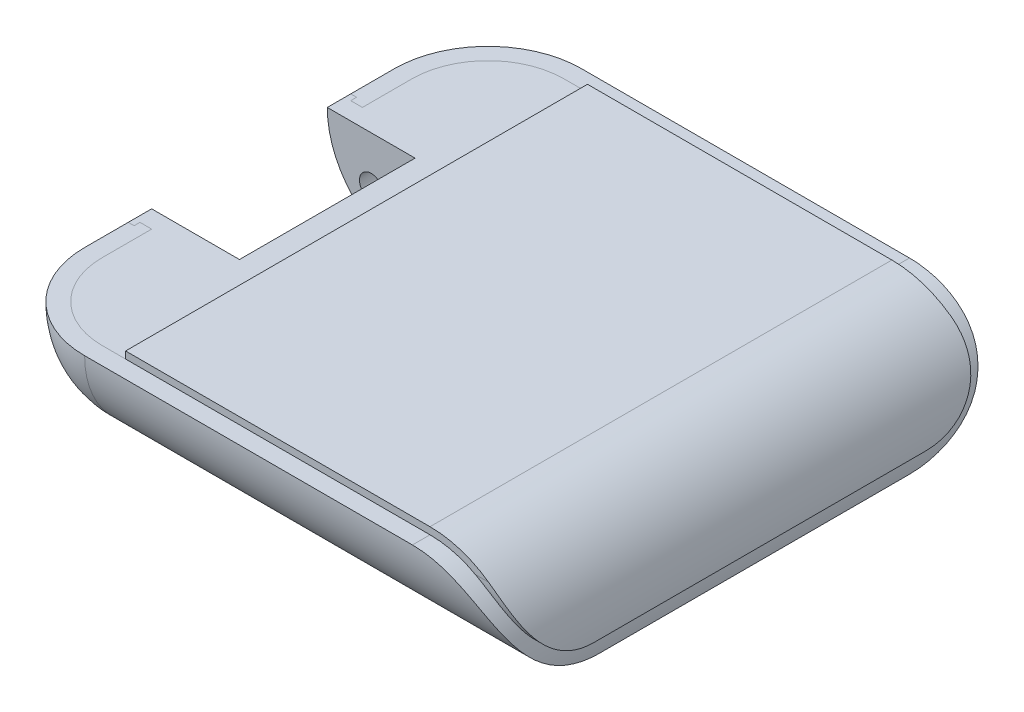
SolidWorks part; units mm, degrees
ref_plane "Front Plane" through (0, 0, 0) normal (0, 0, 1) x (1, 0, 0)
ref_plane "Top Plane" through (0, 0, 0) normal (0, 1, 0) x (1, 0, 0)
ref_plane "Right Plane" through (0, 0, 0) normal (1, 0, 0) x (0, 0, -1)
sketch "Sketch1" plane through (0, 0, 0) normal (0, 1, 0) x (1, 0, 0)
  line L1 (-22, 21.225) -> (22, 21.225)
  line L2 (-22, 21.225) -> (-22, -21.225)
  line L3 (-22, -21.225) -> (22, -21.225)
  line L4 (22, 21.225) -> (22, -21.225)
  point P4 (0, 21.225)
  point P6 (22, 0)
  dimension "D1" = 44
  dimension "D2" = 42.45
extrude "Boss-Extrude1" add sketch "Sketch1" along normal mid plane 8
fillet "Fillet1" radius 8 1 edges at (22, 4, 0)
fillet "Fillet2" radius 8 3 edges at (0, -4, -21.225) (-22, -4, 0) (0, -4, 21.225)
fillet "Fillet3" radius 8 2 edges at (-19.6569, -1.6569, 18.8819) (-19.6569, -1.6569, -18.8819)
sketch "Sketch2" plane through (0, 0, 0) normal (0, 1, 0) x (1, 0, 0)
  line L0 (-22, 13.225) -> (-22, -13.225) construction
  line L1 (-22, 7.5) -> (-14.5, 7.5)
  line L2 (-22, 7.5) -> (-22, -7.5)
  line L3 (-22, -7.5) -> (-14.5, -7.5)
  line L4 (-14.5, 7.5) -> (-14.5, -7.5)
  point P6 (-14.5, 0)
  dimension "D1" = 15
  dimension "D2" = 7.5
extrude "Cut-Extrude1" cut sketch "Sketch2" against normal through all both and the other way through all
shell "Shell3" thickness 1.5
sketch "Sketch19" plane through (0, 4, 0) normal (0, 1, 0) x (1, 0, 0)
  line L0 (-22, 9.5) -> (-21.5, 9.5)
  line L1 (-22, 13.225) -> (-22, 7.5) construction
  line L2 (-21.5, 9.5) -> (-21.5, 9)
  line L3 (-21.5, 9) -> (-13, 9)
  line L4 (-13, 9) -> (-13, -9)
  line L5 (-13, -9) -> (-21.5, -9)
  line L6 (-14.5, 0) -> (0, 0) construction
  line L7 (-14.5, -7.5) -> (-14.5, 7.5) construction
  line L8 (-21.5, -9) -> (-21.5, -9.5)
  line L9 (-21.5, -9.5) -> (-22, -9.5)
  line L10 (-22, -7.5) -> (-22, -13.225) construction
  line L12 (-13, 9) -> (-20.5, 9) construction
  line L13 (-13, -9) -> (-13, 9) construction
  line L14 (-22, 9.5) -> (-22, -9.5)
  dimension "D1" = 0.5
extrude "Cut-Extrude4" cut sketch "Sketch19" against normal through all
sketch "Sketch21" plane through (0, 0, 0) normal (0, 0, 1) x (1, 0, 0)
  line L1 (-14, 4) -> (14, 4) construction
  line L2 (-12, 4) -> (14, 4) construction
  line L3 (-12, 4.6) -> (14, 4.6)
  line L4 (-12, 3.2) -> (14, 3.2)
  line L7 (-12, 4.6) -> (-12, 3.2)
  line L8 (-14, 4.6) -> (14, 4.6) construction
  line L9 (-14, 4) -> (14, 4) construction
  line L10 (-14, 3.2) -> (14, 3.2) construction
  line L11 (21.042, -2.5) -> (22.4682, -2.5)
  line L12 (22, -4) -> (-14, -4) construction
  arc A0 (22, -4) -> (14, 4) centre (14, -4) ccw construction
  arc A1 (21.8581, -2.5) -> (14, 4) centre (14, -4) ccw construction
  arc A2 (22.4682, -2.5) -> (14, 4.6) centre (14, -4) ccw
  arc A3 (21.042, -2.5) -> (14, 3.2) centre (14, -4) ccw
  arc A4 (22.6, -4) -> (14, 4.6) centre (14, -4) ccw construction
  arc A5 (22, -4) -> (14, 4) centre (14, -4) ccw construction
  arc A6 (21.2, -4) -> (14, 3.2) centre (14, -4) ccw construction
  dimension "D1" = 0.6
  dimension "D3" = 10
  dimension "D4" = 1.5
  dimension "D2" = 0.8
extrude "Boss-Extrude4" add sketch "Sketch21" along normal up to vertex and the other way up to vertex separate body
fillet "Fillet7" radius 5.5 2 edges at (21.7551, -2.5, 19.725) (21.7551, -2.5, -19.725)
sketch "Sketch23" plane through (0, 4, 0) normal (0, 1, 0) x (1, 0, 0)
  line L0 (-12, -19.725) -> (-12, 19.725) construction
  line L1 (-12, -19.725) -> (-12, 19.725)
  line L2 (-21.5, 9.5) -> (-22, 9.5) construction
  line L3 (-21.5, 9) -> (-21.5, 9.5) construction
  line L4 (-20.5, 9) -> (-21.5, 9) construction
  line L5 (-20.5, 13.225) -> (-20.5, 9) construction
  line L6 (14, 19.725) -> (-14, 19.725) construction
  line L7 (-21.5, 9.5) -> (-22, 9.5)
  line L8 (-21.5, 9) -> (-21.5, 9.5)
  line L9 (-20.5, 9) -> (-21.5, 9)
  line L10 (-20.5, 13.225) -> (-20.5, 9)
  line L11 (-12, 19.725) -> (-14, 19.725)
  line L12 (-22, -9.5) -> (-21.5, -9.5) construction
  line L13 (-21.5, -9.5) -> (-21.5, -9) construction
  line L14 (-21.5, -9) -> (-20.5, -9) construction
  line L15 (-20.5, -9) -> (-20.5, -13.225) construction
  line L16 (-14, -19.725) -> (14, -19.725) construction
  line L17 (-22, -9.5) -> (-21.5, -9.5)
  line L18 (-21.5, -9.5) -> (-21.5, -9)
  line L19 (-21.5, -9) -> (-20.5, -9)
  line L20 (-20.5, -9) -> (-20.5, -13.225)
  line L21 (-14, -19.725) -> (-12, -19.725)
  line L22 (-22, 9.5) -> (-22, 7.5)
  line L23 (-22, 7.5) -> (-14.5, 7.5)
  line L24 (-14.5, 7.5) -> (-14.5, -7.5)
  line L25 (-14.5, -7.5) -> (-22, -7.5)
  line L26 (-22, -7.5) -> (-22, -9.5)
  arc A0 (-14, 19.725) -> (-20.5, 13.225) centre (-14, 13.225) ccw construction
  arc A1 (-14, 19.725) -> (-20.5, 13.225) centre (-14, 13.225) ccw
  arc A2 (-20.5, -13.225) -> (-14, -19.725) centre (-14, -13.225) ccw construction
  arc A3 (-20.5, -13.225) -> (-14, -19.725) centre (-14, -13.225) ccw
  dimension "D1" = 7.5
  dimension "D2" = 15
extrude "Boss-Extrude5" add sketch "Sketch23" against normal blind 2.5 separate body
sketch "Sketch28" plane through (0, 1.5, 0) normal (0, -1, 0) x (1, 0, 0)
  line L0 (-20.5, 9) -> (-13, 9)
  line L1 (-20.5, -9) -> (-13, -9)
  line L16 (-12, 19.725) -> (-14, 19.725)
  line L17 (-20.5, 13.225) -> (-20.5, 9)
  line L18 (-20.5, 9) -> (-21.5, 9)
  line L19 (-21.5, 9) -> (-21.5, 9.5)
  line L20 (-21.5, 9.5) -> (-22, 9.5)
  line L21 (-22, 9.5) -> (-22, 7.5)
  line L22 (-22, 7.5) -> (-14.5, 7.5)
  line L23 (-14.5, 7.5) -> (-14.5, -7.5)
  line L24 (-14.5, -7.5) -> (-22, -7.5)
  line L25 (-22, -7.5) -> (-22, -9.5)
  line L26 (-22, -9.5) -> (-21.5, -9.5)
  line L27 (-21.5, -9.5) -> (-21.5, -9)
  line L28 (-21.5, -9) -> (-20.5, -9)
  line L29 (-20.5, -9) -> (-20.5, -13.225)
  line L30 (-14, -19.725) -> (-12, -19.725)
  line L31 (-12, -19.725) -> (-12, 19.725)
  line L34 (-20.5, 9) -> (-21.5, 9)
  line L35 (-21.5, 9) -> (-21.5, 9.5)
  line L36 (-21.5, 9.5) -> (-22, 9.5)
  line L37 (-22, 9.5) -> (-22, 7.5)
  line L38 (-22, 7.5) -> (-14.5, 7.5)
  line L39 (-14.5, 7.5) -> (-14.5, -7.5)
  line L40 (-14.5, -7.5) -> (-22, -7.5)
  line L41 (-22, -7.5) -> (-22, -9.5)
  line L42 (-22, -9.5) -> (-21.5, -9.5)
  line L43 (-21.5, -9.5) -> (-21.5, -9)
  line L44 (-21.5, -9) -> (-20.5, -9)
  line L47 (-13, -9) -> (-13, 9)
  arc A2 (-14, 19.725) -> (-20.5, 13.225) centre (-14, 13.225) ccw
  arc A3 (-20.5, -13.225) -> (-14, -19.725) centre (-14, -13.225) ccw
  dimension "D1" = 0
extrude "Boss-Extrude6" add sketch "Sketch28" along normal up to surface separate body
sketch "Sketch24" plane through (0, 0, 0) normal (0, 0, 1) x (1, 0, 0)
  line L2 (-14, -4) -> (-14, 4)
  line L3 (-14, 4) -> (-22, 4)
  line L6 (-22, -4) -> (-22, 4) construction
  line L9 (-21.5, -4) -> (-13, -4) construction
  line L13 (-22, -4) -> (-21.5, -4) construction
  line L14 (-22, -4) -> (-22, 4)
  line L15 (-21.5, -4) -> (-14, -4)
  line L16 (-22, -4) -> (-21.5, -4)
  arc A1 (-22, 4) -> (-14, -4) centre (-14, 4) ccw
  arc A2 (-22, 4) -> (-14, -4) centre (-14, 4) ccw
  dimension "D1" = 0
extrude "Cut-Extrude5" cut sketch "Sketch24" against normal through all both and the other way through all
sketch "Sketch5" plane through (0, 0, 0) normal (0, 0, 1) x (1, 0, 0)
  line L2 (-14, 4) -> (-22, 4) construction
  circle A0 centre (-18.25, 0) radius 1
  dimension "D1" = 2
  dimension "D2" = 3.75
  dimension "D3" = 4
extrude "Cut-Extrude2" cut sketch "Sketch5" against normal up to next and the other way up to next
sketch "Sketch6" plane through (0, -4, 0) normal (0, -1, 0) x (1, 0, 0)
  line L1 (-4.5, 13.5) -> (13, 13.5)
  line L2 (-10.5, 7.5) -> (-10.5, -7.5)
  line L3 (-4.5, -13.5) -> (13, -13.5)
  line L4 (19, 7.5) -> (19, -7.5)
  line L5 (4.25, -13.5) -> (4.25, 13.5) construction
  line L6 (-10.5, 0) -> (19, 0) construction
  line L8 (22, 13.225) -> (22, -13.225) construction
  arc A0 (13, 13.5) -> (19, 7.5) centre (13, 7.5) cw
  arc A1 (13, -13.5) -> (19, -7.5) centre (13, -7.5) ccw
  arc A2 (-10.5, -7.5) -> (-4.5, -13.5) centre (-4.5, -7.5) ccw
  arc A3 (-4.5, 13.5) -> (-10.5, 7.5) centre (-4.5, 7.5) ccw
  point P232 (4.25, 0)
  dimension "D4" = 6
  dimension "D1" = 3
  dimension "D2" = 27
  dimension "D3" = 29.5
extrude "Boss-Extrude2" add sketch "Sketch6" along normal blind 0.6 separate body
sketch "Sketch8" plane through (0, -4.6, 0) normal (0, -1, 0) x (1, 0, 0)
  line L0 (17.2426, 11.7426) -> (-8.7426, -11.7426) construction
  line L1 (-8.7426, 11.7426) -> (17.2426, -11.7426) construction
  arc A0 (19, 7.5) -> (13, 13.5) centre (13, 7.5) ccw construction
  arc A1 (-10.5, -7.5) -> (-4.5, -13.5) centre (-4.5, -7.5) ccw construction
  arc A4 (-4.5, 13.5) -> (-10.5, 7.5) centre (-4.5, 7.5) ccw construction
  arc A5 (13, -13.5) -> (19, -7.5) centre (13, -7.5) ccw construction
  line B0 (4.1065, 3.9974) -> (4.054, 3.8951)
  line B1 (4.054, 3.8951) -> (3.9916, 3.9916)
  line B2 (3.9058, 3.9852) -> (3.8586, 3.8803)
  line B3 (3.8586, 3.8803) -> (3.7914, 3.9736)
  line B4 (3.706, 3.9628) -> (3.6641, 3.8557)
  line B5 (3.6641, 3.8557) -> (3.5923, 3.9456)
  line B6 (3.5076, 3.9305) -> (3.4711, 3.8214)
  line B7 (3.4711, 3.8214) -> (3.3949, 3.9075)
  line B8 (3.311, 3.8882) -> (3.2801, 3.7775)
  line B9 (3.2801, 3.7775) -> (3.1997, 3.8596)
  line B10 (3.1169, 3.8361) -> (3.0915, 3.724)
  line B11 (3.0915, 3.724) -> (3.0071, 3.802)
  line B12 (2.9256, 3.7744) -> (2.9059, 3.6611)
  line B13 (2.9059, 3.6611) -> (2.8176, 3.7347)
  line B14 (2.7376, 3.703) -> (2.7236, 3.5889)
  line B15 (2.7236, 3.5889) -> (2.6318, 3.658)
  line B16 (2.5534, 3.6224) -> (2.5453, 3.5077)
  line B17 (2.5453, 3.5077) -> (2.45, 3.5721)
  line B18 (2.3736, 3.5326) -> (2.3712, 3.4176)
  line B19 (2.3712, 3.4176) -> (2.2728, 3.4772)
  line B20 (2.1985, 3.4338) -> (2.2018, 3.3189)
  line B21 (2.2018, 3.3189) -> (2.1006, 3.3734)
  line B22 (2.0285, 3.3264) -> (2.0377, 3.2118)
  line B23 (2.0377, 3.2118) -> (1.9338, 3.2612)
  line B24 (1.8642, 3.2106) -> (1.8791, 3.0966)
  line B25 (1.8791, 3.0966) -> (1.7729, 3.1407)
  line B26 (1.7059, 3.0867) -> (1.7265, 2.9735)
  line B27 (1.7265, 2.9735) -> (1.6182, 3.0123)
  line B28 (1.554, 2.9549) -> (1.5803, 2.843)
  line B29 (1.5803, 2.843) -> (1.4702, 2.8762)
  line B30 (1.409, 2.8157) -> (1.4408, 2.7052)
  line B31 (1.4408, 2.7052) -> (1.3292, 2.7329)
  line B32 (1.2711, 2.6694) -> (1.3084, 2.5607)
  line B33 (1.3084, 2.5607) -> (1.1956, 2.5827)
  line B34 (1.1407, 2.5164) -> (1.1835, 2.4097)
  line B35 (1.1835, 2.4097) -> (1.0697, 2.426)
  line B36 (1.0182, 2.357) -> (1.0663, 2.2525)
  line B37 (1.0663, 2.2525) -> (0.9518, 2.2631)
  line B38 (0.9039, 2.1916) -> (0.9571, 2.0897)
  line B39 (0.9571, 2.0897) -> (0.8422, 2.0945)
  line B40 (0.798, 2.0207) -> (0.8563, 1.9216)
  line B41 (0.8563, 1.9216) -> (0.7413, 1.9207)
  line B42 (0.7008, 1.8447) -> (0.764, 1.7487)
  line B43 (0.764, 1.7487) -> (0.6492, 1.742)
  line B44 (0.6126, 1.6641) -> (0.6806, 1.5713)
  line B45 (0.6806, 1.5713) -> (0.5663, 1.5588)
  line B46 (0.5336, 1.4792) -> (0.6061, 1.39)
  line B47 (0.6061, 1.39) -> (0.4926, 1.3718)
  line B48 (0.4639, 1.2906) -> (0.5409, 1.2052)
  line B49 (0.5409, 1.2052) -> (0.4284, 1.1813)
  line B50 (0.4039, 1.0988) -> (0.485, 1.0173)
  line B51 (0.485, 1.0173) -> (0.3739, 0.9878)
  line B52 (0.3535, 0.9041) -> (0.4387, 0.8268)
  line B53 (0.4387, 0.8268) -> (0.3291, 0.7918)
  line B54 (0.313, 0.7072) -> (0.4019, 0.6343)
  line B55 (0.4019, 0.6343) -> (0.2943, 0.5938)
  line B56 (0.2825, 0.5085) -> (0.3749, 0.4401)
  line B57 (0.3749, 0.4401) -> (0.2695, 0.3942)
  line B58 (0.2619, 0.3085) -> (0.3577, 0.2449)
  line B59 (0.3577, 0.2449) -> (0.2547, 0.1938)
  line B60 (0.2515, 0.1078) -> (0.3503, 0.049)
  line B61 (0.3503, 0.049) -> (0.25, -0.0072)
  line B62 (0.2511, -0.0933) -> (0.3528, -0.147)
  line B63 (0.3528, -0.147) -> (0.2554, -0.2082)
  line B64 (0.2608, -0.2941) -> (0.3651, -0.3426)
  line B65 (0.3651, -0.3426) -> (0.2709, -0.4086)
  line B66 (0.2806, -0.4942) -> (0.3872, -0.5374)
  line B67 (0.3872, -0.5374) -> (0.2965, -0.6081)
  line B68 (0.3105, -0.693) -> (0.4191, -0.7308)
  line B69 (0.4191, -0.7308) -> (0.332, -0.8059)
  line B70 (0.3503, -0.89) -> (0.4606, -0.9223)
  line B71 (0.4606, -0.9223) -> (0.3775, -1.0018)
  line B72 (0.3999, -1.0848) -> (0.5118, -1.1116)
  line B73 (0.5118, -1.1116) -> (0.4327, -1.1951)
  line B74 (0.4593, -1.2769) -> (0.5723, -1.298)
  line B75 (0.5723, -1.298) -> (0.4976, -1.3854)
  line B76 (0.5282, -1.4658) -> (0.6422, -1.4811)
  line B77 (0.6422, -1.4811) -> (0.5719, -1.5721)
  line B78 (0.6066, -1.6509) -> (0.7212, -1.6605)
  line B79 (0.7212, -1.6605) -> (0.6555, -1.755)
  line B80 (0.6941, -1.8319) -> (0.8091, -1.8357)
  line B81 (0.8091, -1.8357) -> (0.7483, -1.9333)
  line B82 (0.7907, -2.0082) -> (0.9056, -2.0063)
  line B83 (0.9056, -2.0063) -> (0.8498, -2.1069)
  line B84 (0.8959, -2.1795) -> (1.0107, -2.1718)
  line B85 (1.0107, -2.1718) -> (0.96, -2.275)
  line B86 (1.0097, -2.3453) -> (1.1239, -2.3318)
  line B87 (1.1239, -2.3318) -> (1.0784, -2.4375)
  line B88 (1.1316, -2.5051) -> (1.245, -2.486)
  line B89 (1.245, -2.486) -> (1.2049, -2.5937)
  line B90 (1.2614, -2.6586) -> (1.3737, -2.6338)
  line B91 (1.3737, -2.6338) -> (1.3391, -2.7435)
  line B92 (1.3988, -2.8054) -> (1.5097, -2.775)
  line B93 (1.5097, -2.775) -> (1.4806, -2.8862)
  line B94 (1.5433, -2.9452) -> (1.6526, -2.9092)
  line B95 (1.6526, -2.9092) -> (1.6291, -3.0217)
  line B96 (1.6947, -3.0774) -> (1.802, -3.036)
  line B97 (1.802, -3.036) -> (1.7843, -3.1496)
  line B98 (1.8526, -3.2019) -> (1.9576, -3.1552)
  line B99 (1.9576, -3.1552) -> (1.9456, -3.2695)
  line B100 (2.0165, -3.3184) -> (2.1191, -3.2664)
  line B101 (2.1191, -3.2664) -> (2.1128, -3.3812)
  line B102 (2.186, -3.4264) -> (2.2859, -3.3693)
  line B103 (2.2859, -3.3693) -> (2.2854, -3.4843)
  line B104 (2.3608, -3.5258) -> (2.4576, -3.4637)
  line B105 (2.4576, -3.4637) -> (2.4629, -3.5786)
  line B106 (2.5403, -3.6162) -> (2.6339, -3.5494)
  line B107 (2.6339, -3.5494) -> (2.645, -3.6639)
  line B108 (2.7242, -3.6976) -> (2.8143, -3.6261)
  line B109 (2.8143, -3.6261) -> (2.8311, -3.7399)
  line B110 (2.9119, -3.7695) -> (2.9983, -3.6937)
  line B111 (2.9983, -3.6937) -> (3.0208, -3.8065)
  line B112 (3.103, -3.832) -> (3.1855, -3.7519)
  line B113 (3.1855, -3.7519) -> (3.2136, -3.8634)
  line B114 (3.297, -3.8848) -> (3.3753, -3.8007)
  line B115 (3.3753, -3.8007) -> (3.409, -3.9106)
  line B116 (3.4934, -3.9278) -> (3.5674, -3.8398)
  line B117 (3.5674, -3.8398) -> (3.6066, -3.9479)
  line B118 (3.6917, -3.9608) -> (3.7612, -3.8692)
  line B119 (3.7612, -3.8692) -> (3.8058, -3.9753)
  line B120 (3.8914, -3.9839) -> (3.9562, -3.8889)
  line B121 (3.9562, -3.8889) -> (4.0061, -3.9926)
  line B122 (4.092, -3.9969) -> (4.152, -3.8988)
  line B123 (4.152, -3.8988) -> (4.207, -3.9998)
  line B124 (4.293, -3.9998) -> (4.348, -3.8988)
  line B125 (4.348, -3.8988) -> (4.408, -3.9969)
  line B126 (4.4939, -3.9926) -> (4.5438, -3.8889)
  line B127 (4.5438, -3.8889) -> (4.6086, -3.9839)
  line B128 (4.6942, -3.9753) -> (4.7388, -3.8692)
  line B129 (4.7388, -3.8692) -> (4.8083, -3.9608)
  line B130 (4.8934, -3.9479) -> (4.9326, -3.8398)
  line B131 (4.9326, -3.8398) -> (5.0066, -3.9278)
  line B132 (5.091, -3.9106) -> (5.1247, -3.8007)
  line B133 (5.1247, -3.8007) -> (5.203, -3.8848)
  line B134 (5.2864, -3.8634) -> (5.3145, -3.7519)
  line B135 (5.3145, -3.7519) -> (5.397, -3.832)
  line B136 (5.4792, -3.8065) -> (5.5017, -3.6937)
  line B137 (5.5017, -3.6937) -> (5.5881, -3.7695)
  line B138 (5.6689, -3.7399) -> (5.6857, -3.6261)
  line B139 (5.6857, -3.6261) -> (5.7758, -3.6976)
  line B140 (5.855, -3.6639) -> (5.8661, -3.5494)
  line B141 (5.8661, -3.5494) -> (5.9597, -3.6162)
  line B142 (6.0371, -3.5786) -> (6.0424, -3.4637)
  line B143 (6.0424, -3.4637) -> (6.1392, -3.5258)
  line B144 (6.2146, -3.4843) -> (6.2141, -3.3693)
  line B145 (6.2141, -3.3693) -> (6.314, -3.4264)
  line B146 (6.3872, -3.3812) -> (6.3809, -3.2664)
  line B147 (6.3809, -3.2664) -> (6.4835, -3.3184)
  line B148 (6.5544, -3.2695) -> (6.5424, -3.1552)
  line B149 (6.5424, -3.1552) -> (6.6474, -3.2019)
  line B150 (6.7157, -3.1496) -> (6.698, -3.036)
  line B151 (6.698, -3.036) -> (6.8053, -3.0774)
  line B152 (6.8709, -3.0217) -> (6.8474, -2.9092)
  line B153 (6.8474, -2.9092) -> (6.9567, -2.9452)
  line B154 (7.0194, -2.8862) -> (6.9903, -2.775)
  line B155 (6.9903, -2.775) -> (7.1012, -2.8054)
  line B156 (7.1609, -2.7435) -> (7.1263, -2.6338)
  line B157 (7.1263, -2.6338) -> (7.2386, -2.6586)
  line B158 (7.2951, -2.5937) -> (7.255, -2.486)
  line B159 (7.255, -2.486) -> (7.3684, -2.5051)
  line B160 (7.4216, -2.4375) -> (7.3761, -2.3318)
  line B161 (7.3761, -2.3318) -> (7.4903, -2.3453)
  line B162 (7.54, -2.275) -> (7.4893, -2.1718)
  line B163 (7.4893, -2.1718) -> (7.6041, -2.1795)
  line B164 (7.6502, -2.1069) -> (7.5944, -2.0063)
  line B165 (7.5944, -2.0063) -> (7.7093, -2.0082)
  line B166 (7.7517, -1.9333) -> (7.6909, -1.8357)
  line B167 (7.6909, -1.8357) -> (7.8059, -1.8319)
  line B168 (7.8445, -1.755) -> (7.7788, -1.6605)
  line B169 (7.7788, -1.6605) -> (7.8934, -1.6509)
  line B170 (7.9281, -1.5721) -> (7.8578, -1.4811)
  line B171 (7.8578, -1.4811) -> (7.9718, -1.4658)
  line B172 (8.0024, -1.3854) -> (7.9277, -1.298)
  line B173 (7.9277, -1.298) -> (8.0407, -1.2769)
  line B174 (8.0673, -1.1951) -> (7.9882, -1.1116)
  line B175 (7.9882, -1.1116) -> (8.1001, -1.0848)
  line B176 (8.1225, -1.0018) -> (8.0394, -0.9223)
  line B177 (8.0394, -0.9223) -> (8.1497, -0.89)
  line B178 (8.168, -0.8059) -> (8.0809, -0.7308)
  line B179 (8.0809, -0.7308) -> (8.1895, -0.693)
  line B180 (8.2035, -0.6081) -> (8.1128, -0.5374)
  line B181 (8.1128, -0.5374) -> (8.2194, -0.4942)
  line B182 (8.2291, -0.4086) -> (8.1349, -0.3426)
  line B183 (8.1349, -0.3426) -> (8.2392, -0.2941)
  line B184 (8.2446, -0.2082) -> (8.1472, -0.147)
  line B185 (8.1472, -0.147) -> (8.2489, -0.0933)
  line B186 (8.25, -0.0072) -> (8.1497, 0.049)
  line B187 (8.1497, 0.049) -> (8.2485, 0.1078)
  line B188 (8.2453, 0.1938) -> (8.1423, 0.2449)
  line B189 (8.1423, 0.2449) -> (8.2381, 0.3085)
  line B190 (8.2305, 0.3942) -> (8.1251, 0.4401)
  line B191 (8.1251, 0.4401) -> (8.2175, 0.5085)
  line B192 (8.2057, 0.5938) -> (8.0981, 0.6343)
  line B193 (8.0981, 0.6343) -> (8.187, 0.7072)
  line B194 (8.1709, 0.7918) -> (8.0613, 0.8268)
  line B195 (8.0613, 0.8268) -> (8.1465, 0.9041)
  line B196 (8.1261, 0.9878) -> (8.015, 1.0173)
  line B197 (8.015, 1.0173) -> (8.0961, 1.0988)
  line B198 (8.0716, 1.1813) -> (7.9591, 1.2052)
  line B199 (7.9591, 1.2052) -> (8.0361, 1.2906)
  line B200 (8.0074, 1.3718) -> (7.8939, 1.39)
  line B201 (7.8939, 1.39) -> (7.9664, 1.4792)
  line B202 (7.9337, 1.5588) -> (7.8194, 1.5713)
  line B203 (7.8194, 1.5713) -> (7.8874, 1.6641)
  line B204 (7.8508, 1.742) -> (7.736, 1.7487)
  line B205 (7.736, 1.7487) -> (7.7992, 1.8447)
  line B206 (7.7587, 1.9207) -> (7.6437, 1.9216)
  line B207 (7.6437, 1.9216) -> (7.702, 2.0207)
  line B208 (7.6578, 2.0945) -> (7.5429, 2.0897)
  line B209 (7.5429, 2.0897) -> (7.5961, 2.1916)
  line B210 (7.5482, 2.2631) -> (7.4337, 2.2525)
  line B211 (7.4337, 2.2525) -> (7.4818, 2.357)
  line B212 (7.4303, 2.426) -> (7.3165, 2.4097)
  line B213 (7.3165, 2.4097) -> (7.3593, 2.5164)
  line B214 (7.3044, 2.5827) -> (7.1916, 2.5607)
  line B215 (7.1916, 2.5607) -> (7.2289, 2.6694)
  line B216 (7.1708, 2.7329) -> (7.0592, 2.7052)
  line B217 (7.0592, 2.7052) -> (7.091, 2.8157)
  line B218 (7.0298, 2.8762) -> (6.9197, 2.843)
  line B219 (6.9197, 2.843) -> (6.946, 2.9549)
  line B220 (6.8818, 3.0123) -> (6.7735, 2.9735)
  line B221 (6.7735, 2.9735) -> (6.7941, 3.0867)
  line B222 (6.7271, 3.1407) -> (6.6209, 3.0966)
  line B223 (6.6209, 3.0966) -> (6.6358, 3.2106)
  line B224 (6.5662, 3.2612) -> (6.4623, 3.2118)
  line B225 (6.4623, 3.2118) -> (6.4715, 3.3264)
  line B226 (6.3994, 3.3734) -> (6.2982, 3.3189)
  line B227 (6.2982, 3.3189) -> (6.3015, 3.4338)
  line B228 (6.2272, 3.4772) -> (6.1288, 3.4176)
  line B229 (6.1288, 3.4176) -> (6.1264, 3.5326)
  line B230 (6.05, 3.5721) -> (5.9547, 3.5077)
  line B231 (5.9547, 3.5077) -> (5.9466, 3.6224)
  line B232 (5.8682, 3.658) -> (5.7764, 3.5889)
  line B233 (5.7764, 3.5889) -> (5.7624, 3.703)
  line B234 (5.6824, 3.7347) -> (5.5941, 3.6611)
  line B235 (5.5941, 3.6611) -> (5.5744, 3.7744)
  line B236 (5.4929, 3.802) -> (5.4085, 3.724)
  line B237 (5.4085, 3.724) -> (5.3831, 3.8361)
  line B238 (5.3003, 3.8596) -> (5.2199, 3.7775)
  line B239 (5.2199, 3.7775) -> (5.189, 3.8882)
  line B240 (5.1051, 3.9075) -> (5.0289, 3.8214)
  line B241 (5.0289, 3.8214) -> (4.9924, 3.9305)
  line B242 (4.9077, 3.9456) -> (4.8359, 3.8557)
  line B243 (4.8359, 3.8557) -> (4.794, 3.9628)
  line B244 (4.7086, 3.9736) -> (4.6414, 3.8803)
  line B245 (4.6414, 3.8803) -> (4.5942, 3.9852)
  line B246 (4.5084, 3.9916) -> (4.4459, 3.8951)
  line B247 (4.4459, 3.8951) -> (4.3935, 3.9974)
  line B248 (4.3075, 3.9996) -> (4.25, 3.9)
  line B249 (4.25, 3.9) -> (4.1925, 3.9996)
  arc B250 (3.9916, 3.9916) -> (3.9058, 3.9852) centre (4.25, 0) ccw
  arc B251 (3.7914, 3.9736) -> (3.706, 3.9628) centre (4.25, 0) ccw
  arc B252 (3.5923, 3.9456) -> (3.5076, 3.9305) centre (4.25, 0) ccw
  arc B253 (3.3949, 3.9075) -> (3.311, 3.8882) centre (4.25, 0) ccw
  arc B254 (3.1997, 3.8596) -> (3.1169, 3.8361) centre (4.25, 0) ccw
  arc B255 (3.0071, 3.802) -> (2.9256, 3.7744) centre (4.25, 0) ccw
  arc B256 (2.8176, 3.7347) -> (2.7376, 3.703) centre (4.25, 0) ccw
  arc B257 (2.6318, 3.658) -> (2.5534, 3.6224) centre (4.25, 0) ccw
  arc B258 (2.45, 3.5721) -> (2.3736, 3.5326) centre (4.25, 0) ccw
  arc B259 (2.2728, 3.4772) -> (2.1985, 3.4338) centre (4.25, 0) ccw
  arc B260 (2.1006, 3.3734) -> (2.0285, 3.3264) centre (4.25, 0) ccw
  arc B261 (1.9338, 3.2612) -> (1.8642, 3.2106) centre (4.25, 0) ccw
  arc B262 (1.7729, 3.1407) -> (1.7059, 3.0867) centre (4.25, 0) ccw
  arc B263 (1.6182, 3.0123) -> (1.554, 2.9549) centre (4.25, 0) ccw
  arc B264 (1.4702, 2.8762) -> (1.409, 2.8157) centre (4.25, 0) ccw
  arc B265 (1.3292, 2.7329) -> (1.2711, 2.6694) centre (4.25, 0) ccw
  arc B266 (1.1956, 2.5827) -> (1.1407, 2.5164) centre (4.25, 0) ccw
  arc B267 (1.0697, 2.426) -> (1.0182, 2.357) centre (4.25, 0) ccw
  arc B268 (0.9518, 2.2631) -> (0.9039, 2.1916) centre (4.25, 0) ccw
  arc B269 (0.8422, 2.0945) -> (0.798, 2.0207) centre (4.25, 0) ccw
  arc B270 (0.7413, 1.9207) -> (0.7008, 1.8447) centre (4.25, 0) ccw
  arc B271 (0.6492, 1.742) -> (0.6126, 1.6641) centre (4.25, 0) ccw
  arc B272 (0.5663, 1.5588) -> (0.5336, 1.4792) centre (4.25, 0) ccw
  arc B273 (0.4926, 1.3718) -> (0.4639, 1.2906) centre (4.25, 0) ccw
  arc B274 (0.4284, 1.1813) -> (0.4039, 1.0988) centre (4.25, 0) ccw
  arc B275 (0.3739, 0.9878) -> (0.3535, 0.9041) centre (4.25, 0) ccw
  arc B276 (0.3291, 0.7918) -> (0.313, 0.7072) centre (4.25, 0) ccw
  arc B277 (0.2943, 0.5938) -> (0.2825, 0.5085) centre (4.25, 0) ccw
  arc B278 (0.2695, 0.3942) -> (0.2619, 0.3085) centre (4.25, 0) ccw
  arc B279 (0.2547, 0.1938) -> (0.2515, 0.1078) centre (4.25, 0) ccw
  arc B280 (0.25, -0.0072) -> (0.2511, -0.0933) centre (4.25, 0) ccw
  arc B281 (0.2554, -0.2082) -> (0.2608, -0.2941) centre (4.25, 0) ccw
  arc B282 (0.2709, -0.4086) -> (0.2806, -0.4942) centre (4.25, 0) ccw
  arc B283 (0.2965, -0.6081) -> (0.3105, -0.693) centre (4.25, 0) ccw
  arc B284 (0.332, -0.8059) -> (0.3503, -0.89) centre (4.25, 0) ccw
  arc B285 (0.3775, -1.0018) -> (0.3999, -1.0848) centre (4.25, 0) ccw
  arc B286 (0.4327, -1.1951) -> (0.4593, -1.2769) centre (4.25, 0) ccw
  arc B287 (0.4976, -1.3854) -> (0.5282, -1.4658) centre (4.25, 0) ccw
  arc B288 (0.5719, -1.5721) -> (0.6066, -1.6509) centre (4.25, 0) ccw
  arc B289 (0.6555, -1.755) -> (0.6941, -1.8319) centre (4.25, 0) ccw
  arc B290 (0.7483, -1.9333) -> (0.7907, -2.0082) centre (4.25, 0) ccw
  arc B291 (0.8498, -2.1069) -> (0.8959, -2.1795) centre (4.25, 0) ccw
  arc B292 (0.96, -2.275) -> (1.0097, -2.3453) centre (4.25, 0) ccw
  arc B293 (1.0784, -2.4375) -> (1.1316, -2.5051) centre (4.25, 0) ccw
  arc B294 (1.2049, -2.5937) -> (1.2614, -2.6586) centre (4.25, 0) ccw
  arc B295 (1.3391, -2.7435) -> (1.3988, -2.8054) centre (4.25, 0) ccw
  arc B296 (1.4806, -2.8862) -> (1.5433, -2.9452) centre (4.25, 0) ccw
  arc B297 (1.6291, -3.0217) -> (1.6947, -3.0774) centre (4.25, 0) ccw
  arc B298 (1.7843, -3.1496) -> (1.8526, -3.2019) centre (4.25, 0) ccw
  arc B299 (1.9456, -3.2695) -> (2.0165, -3.3184) centre (4.25, 0) ccw
  arc B300 (2.1128, -3.3812) -> (2.186, -3.4264) centre (4.25, 0) ccw
  arc B301 (2.2854, -3.4843) -> (2.3608, -3.5258) centre (4.25, 0) ccw
  arc B302 (2.4629, -3.5786) -> (2.5403, -3.6162) centre (4.25, 0) ccw
  arc B303 (2.645, -3.6639) -> (2.7242, -3.6976) centre (4.25, 0) ccw
  arc B304 (2.8311, -3.7399) -> (2.9119, -3.7695) centre (4.25, 0) ccw
  arc B305 (3.0208, -3.8065) -> (3.103, -3.832) centre (4.25, 0) ccw
  arc B306 (3.2136, -3.8634) -> (3.297, -3.8848) centre (4.25, 0) ccw
  arc B307 (3.409, -3.9106) -> (3.4934, -3.9278) centre (4.25, 0) ccw
  arc B308 (3.6066, -3.9479) -> (3.6917, -3.9608) centre (4.25, 0) ccw
  arc B309 (3.8058, -3.9753) -> (3.8914, -3.9839) centre (4.25, 0) ccw
  arc B310 (4.0061, -3.9926) -> (4.092, -3.9969) centre (4.25, 0) ccw
  arc B311 (4.207, -3.9998) -> (4.293, -3.9998) centre (4.25, 0) ccw
  arc B312 (4.408, -3.9969) -> (4.4939, -3.9926) centre (4.25, 0) ccw
  arc B313 (4.6086, -3.9839) -> (4.6942, -3.9753) centre (4.25, 0) ccw
  arc B314 (4.8083, -3.9608) -> (4.8934, -3.9479) centre (4.25, 0) ccw
  arc B315 (5.0066, -3.9278) -> (5.091, -3.9106) centre (4.25, 0) ccw
  arc B316 (5.203, -3.8848) -> (5.2864, -3.8634) centre (4.25, 0) ccw
  arc B317 (5.397, -3.832) -> (5.4792, -3.8065) centre (4.25, 0) ccw
  arc B318 (5.5881, -3.7695) -> (5.6689, -3.7399) centre (4.25, 0) ccw
  arc B319 (5.7758, -3.6976) -> (5.855, -3.6639) centre (4.25, 0) ccw
  arc B320 (5.9597, -3.6162) -> (6.0371, -3.5786) centre (4.25, 0) ccw
  arc B321 (6.1392, -3.5258) -> (6.2146, -3.4843) centre (4.25, 0) ccw
  arc B322 (6.314, -3.4264) -> (6.3872, -3.3812) centre (4.25, 0) ccw
  arc B323 (6.4835, -3.3184) -> (6.5544, -3.2695) centre (4.25, 0) ccw
  arc B324 (6.6474, -3.2019) -> (6.7157, -3.1496) centre (4.25, 0) ccw
  arc B325 (6.8053, -3.0774) -> (6.8709, -3.0217) centre (4.25, 0) ccw
  arc B326 (6.9567, -2.9452) -> (7.0194, -2.8862) centre (4.25, 0) ccw
  arc B327 (7.1012, -2.8054) -> (7.1609, -2.7435) centre (4.25, 0) ccw
  arc B328 (7.2386, -2.6586) -> (7.2951, -2.5937) centre (4.25, 0) ccw
  arc B329 (7.3684, -2.5051) -> (7.4216, -2.4375) centre (4.25, 0) ccw
  arc B330 (7.4903, -2.3453) -> (7.54, -2.275) centre (4.25, 0) ccw
  arc B331 (7.6041, -2.1795) -> (7.6502, -2.1069) centre (4.25, 0) ccw
  arc B332 (7.7093, -2.0082) -> (7.7517, -1.9333) centre (4.25, 0) ccw
  arc B333 (7.8059, -1.8319) -> (7.8445, -1.755) centre (4.25, 0) ccw
  arc B334 (7.8934, -1.6509) -> (7.9281, -1.5721) centre (4.25, 0) ccw
  arc B335 (7.9718, -1.4658) -> (8.0024, -1.3854) centre (4.25, 0) ccw
  arc B336 (8.0407, -1.2769) -> (8.0673, -1.1951) centre (4.25, 0) ccw
  arc B337 (8.1001, -1.0848) -> (8.1225, -1.0018) centre (4.25, 0) ccw
  arc B338 (8.1497, -0.89) -> (8.168, -0.8059) centre (4.25, 0) ccw
  arc B339 (8.1895, -0.693) -> (8.2035, -0.6081) centre (4.25, 0) ccw
  arc B340 (8.2194, -0.4942) -> (8.2291, -0.4086) centre (4.25, 0) ccw
  arc B341 (8.2392, -0.2941) -> (8.2446, -0.2082) centre (4.25, 0) ccw
  arc B342 (8.2489, -0.0933) -> (8.25, -0.0072) centre (4.25, 0) ccw
  arc B343 (8.2485, 0.1078) -> (8.2453, 0.1938) centre (4.25, 0) ccw
  arc B344 (8.2381, 0.3085) -> (8.2305, 0.3942) centre (4.25, 0) ccw
  arc B345 (8.2175, 0.5085) -> (8.2057, 0.5938) centre (4.25, 0) ccw
  arc B346 (8.187, 0.7072) -> (8.1709, 0.7918) centre (4.25, 0) ccw
  arc B347 (8.1465, 0.9041) -> (8.1261, 0.9878) centre (4.25, 0) ccw
  arc B348 (8.0961, 1.0988) -> (8.0716, 1.1813) centre (4.25, 0) ccw
  arc B349 (8.0361, 1.2906) -> (8.0074, 1.3718) centre (4.25, 0) ccw
  arc B350 (7.9664, 1.4792) -> (7.9337, 1.5588) centre (4.25, 0) ccw
  arc B351 (7.8874, 1.6641) -> (7.8508, 1.742) centre (4.25, 0) ccw
  arc B352 (7.7992, 1.8447) -> (7.7587, 1.9207) centre (4.25, 0) ccw
  arc B353 (7.702, 2.0207) -> (7.6578, 2.0945) centre (4.25, 0) ccw
  arc B354 (7.5961, 2.1916) -> (7.5482, 2.2631) centre (4.25, 0) ccw
  arc B355 (7.4818, 2.357) -> (7.4303, 2.426) centre (4.25, 0) ccw
  arc B356 (7.3593, 2.5164) -> (7.3044, 2.5827) centre (4.25, 0) ccw
  arc B357 (7.2289, 2.6694) -> (7.1708, 2.7329) centre (4.25, 0) ccw
  arc B358 (7.091, 2.8157) -> (7.0298, 2.8762) centre (4.25, 0) ccw
  arc B359 (6.946, 2.9549) -> (6.8818, 3.0123) centre (4.25, 0) ccw
  arc B360 (6.7941, 3.0867) -> (6.7271, 3.1407) centre (4.25, 0) ccw
  arc B361 (6.6358, 3.2106) -> (6.5662, 3.2612) centre (4.25, 0) ccw
  arc B362 (6.4715, 3.3264) -> (6.3994, 3.3734) centre (4.25, 0) ccw
  arc B363 (6.3015, 3.4338) -> (6.2272, 3.4772) centre (4.25, 0) ccw
  arc B364 (6.1264, 3.5326) -> (6.05, 3.5721) centre (4.25, 0) ccw
  arc B365 (5.9466, 3.6224) -> (5.8682, 3.658) centre (4.25, 0) ccw
  arc B366 (5.7624, 3.703) -> (5.6824, 3.7347) centre (4.25, 0) ccw
  arc B367 (5.5744, 3.7744) -> (5.4929, 3.802) centre (4.25, 0) ccw
  arc B368 (5.3831, 3.8361) -> (5.3003, 3.8596) centre (4.25, 0) ccw
  arc B369 (5.189, 3.8882) -> (5.1051, 3.9075) centre (4.25, 0) ccw
  arc B370 (4.9924, 3.9305) -> (4.9077, 3.9456) centre (4.25, 0) ccw
  arc B371 (4.794, 3.9628) -> (4.7086, 3.9736) centre (4.25, 0) ccw
  arc B372 (4.5942, 3.9852) -> (4.5084, 3.9916) centre (4.25, 0) ccw
  arc B373 (4.3935, 3.9974) -> (4.3075, 3.9996) centre (4.25, 0) ccw
  arc B374 (4.1925, 3.9996) -> (4.1065, 3.9974) centre (4.25, 0) ccw
sketch_block_instance "Block1-1"
sketch_block "Block1"
extrude "Cut-Extrude3" cut sketch "Sketch8" against normal blind 5.6
sketch "Sketch30" plane through (0, -4.6, 0) normal (0, -1, 0) x (1, 0, 0)
  line L0 (17.2426, 11.7426) -> (-8.7426, -11.7426) construction
  arc A0 (19, 7.5) -> (13, 13.5) centre (13, 7.5) ccw construction
  arc A1 (-10.5, -7.5) -> (-4.5, -13.5) centre (-4.5, -7.5) ccw construction
  circle A2 centre (4.25, 0) radius 4
  dimension "D1" = 8
extrude "Cut-Extrude15" cut sketch "Sketch30" against normal up to surface (0.6 mm away)
sketch "Sketch32" plane through (0, -2.5, 0) normal (0, 1, 0) x (1, 0, 0)
  circle A0 centre (4.25, 0) radius 6.5
  circle A1 centre (4.25, 0) radius 4
  circle A2 centre (4.25, 0) radius 4 construction
  dimension "D2" = 13
  dimension "D1" = 0
extrude "Boss-Extrude7" add sketch "Sketch32" along normal blind 2.5
fillet "Fillet8" radius 2.5 3 edges at (-20.5, 1.5, 11.1125) (-18.5962, 1.5, 17.8212) (-13, 1.5, 19.725)
